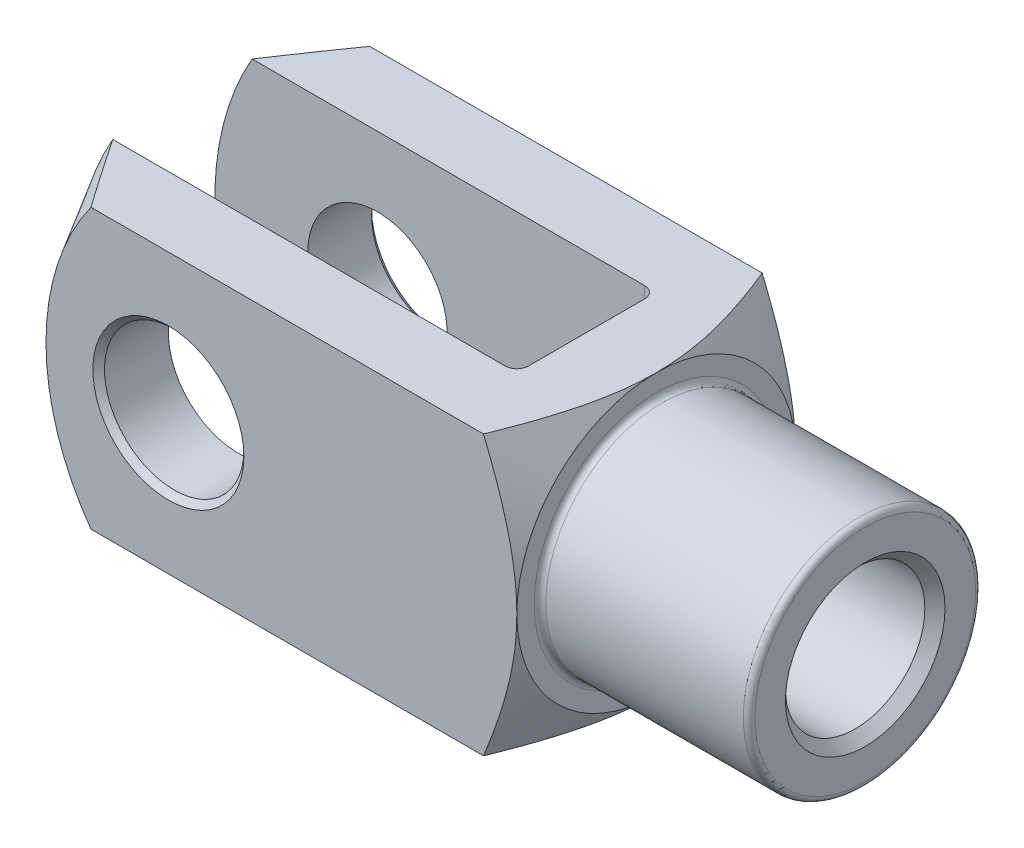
SolidWorks part; units mm, degrees
ref_plane "Front Plane" through (0, 0, 0) normal (0, 0, 1) x (1, 0, 0)
ref_plane "Top Plane" through (0, 0, 0) normal (0, 1, 0) x (1, 0, 0)
ref_plane "Right Plane" through (0, 0, 0) normal (1, 0, 0) x (0, 0, -1)
sketch "Sketch1" plane through (0, 0, 0) normal (1, 0, 0) x (0, 0, -1)
  line L0 (0, 0) -> (0, 50000) construction
  line L1 (0, 0) -> (50000, 0) construction
  line L2 (-12, -12) -> (-12, 12)
  line L3 (-12, 12) -> (12, 12)
  line L4 (12, -12) -> (12, 12)
  line L5 (-12, -12) -> (12, -12)
  point P9 (0, 12)
  point P11 (12, 0)
  point P12 (-12, 0)
  dimension "D1" = 24
  dimension "D2" = 24
extrude "Extrude1" add sketch "Sketch1" against normal blind 62
sketch "Sketch2" plane through (0, 0, 0) normal (1, 0, 0) x (0, 0, -1)
  circle A0 centre (0, 0) radius 10
  circle A1 centre (0, 0) radius 20
  dimension "D1" = 20
  dimension "D2" = 40
extrude "Extrude2" cut sketch "Sketch2" against normal blind 18
sketch "Sketch3" plane through (0, 0, 12) normal (0, 0, 1) x (1, 0, 0)
  circle A0 centre (-48, 0) radius 6
  dimension "D1" = 12
  dimension "D2" = 48
extrude "Extrude3" cut sketch "Sketch3" against normal through all
sketch "Sketch4" plane through (0, 12, 0) normal (0, 1, 0) x (1, 0, 0)
  line L0 (0, 0) -> (-50000, 0) construction
  line L1 (-62, -6) -> (-62, 6)
  line L2 (-62, 12) -> (-62, -12) construction
  line L3 (-62, 6) -> (-24, 6)
  line L4 (-24, 6) -> (-24, -6)
  line L5 (-48, 12) -> (-48, -12) construction
  line L6 (-62, -6) -> (-24, -6)
  point P7 (-48, 0)
  point P13 (-24, 0)
  point P14 (-62, 0)
  dimension "D1" = 24
  dimension "D2" = 12
extrude "Extrude4" cut sketch "Sketch4" against normal through all
fillet "Fillet1" radius 1 2 edges at (-24, 0, 6) (-24, 0, -6)
fillet "Fillet2" radius 0.5 2 edges at (0, 0, -10) (-18, 0, -10)
chamfer "Chamfer2" distance 0.5 angle 45 2 edges at (-42, 0, -12) (-42, 0, 12)
sketch "Sketch6" plane through (0, 0, 0) normal (0, 0, 1) x (1, 0, 0)
  line L0 (-18, -12) -> (-18, -24)
  line L1 (-18, -24) -> (-24.9282, -24)
  line L2 (-24.9282, -24) -> (-18, -12)
  dimension "D1" = 30
  dimension "D2" = 24
revolve "Cut-Revolve1" cut sketch "Sketch6" angle 360 about axis through (-18, 0, 0) along (1, 0, 0)
sketch "Sketch7" plane through (0, 0, 0) normal (0, 1, 0) x (1, 0, 0)
  line L0 (-58.5359, -12) -> (-62, -6)
  line L1 (-62, 6) -> (-58.5359, 12)
  line L2 (-58.5359, 12) -> (-86, 12)
  line L3 (-62, 6) -> (-62, -6)
  line L4 (-86, 12) -> (-86, -12)
  line L5 (-86, -12) -> (-58.5359, -12)
  line L6 (-62, 12) -> (-20.8698, 12) construction
  line L7 (-62, -12) -> (-20.8698, -12) construction
  line L8 (-38, 0.6162) -> (-38, 50000.6162) construction
  dimension "D1" = 120
  dimension "D2" = 24
  dimension "D3" = 24
revolve "Cut-Revolve2" cut sketch "Sketch7" angle 180 about L8
sketch "Sketch8" plane through (0, 0, 0) normal (1, 0, 0) x (0, 0, -1)
  circle A0 centre (0, 0) radius 6
  dimension "D1" = 12
extrude "Extrude5" cut sketch "Sketch8" against normal through all
chamfer "Chamfer3" distance 0.87 angle 45 1 edges at (0, 0, -6)
equation "\"D2@Sketch1\" = \"D1@Sketch1\""
equation "\"D2@Sketch2\" = \"D1@Sketch2\"*2"
equation "\"D2@Sketch6\" = \"D1@Sketch1\""
equation "\"D2@Sketch7\" = \"D1@Sketch1\""
equation "\"D3@Sketch7\" = \"D1@Sketch1\""
